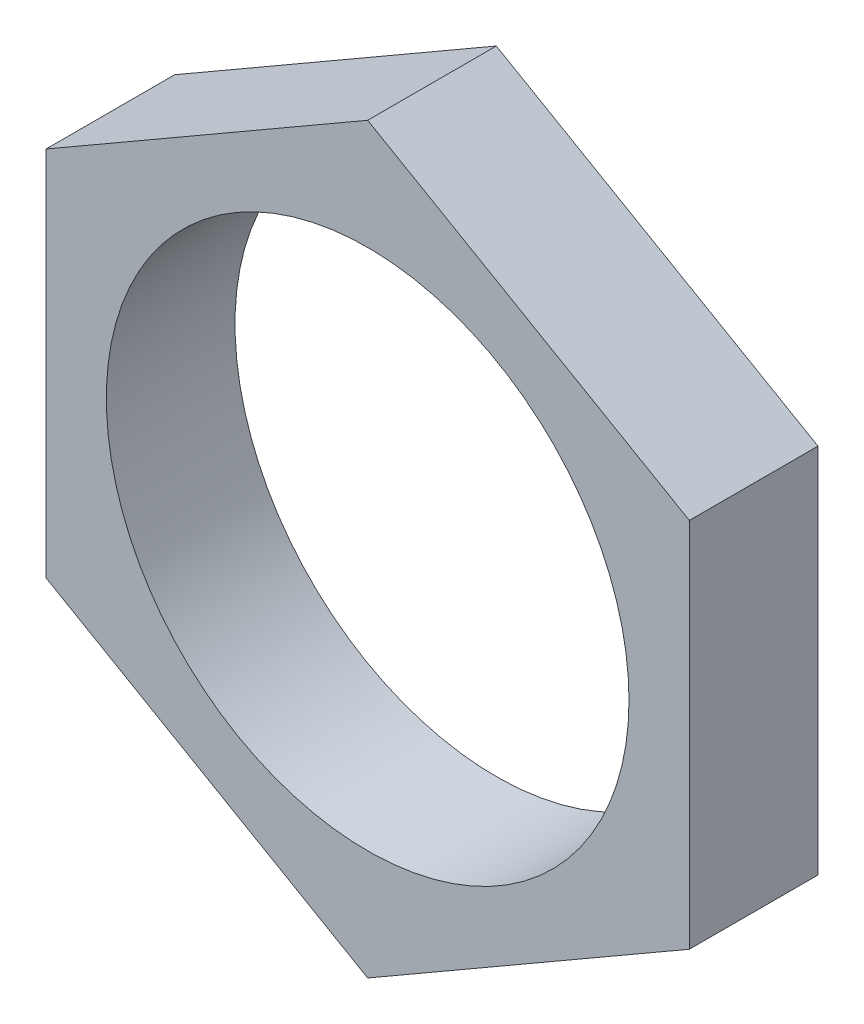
SolidWorks part; units mm, degrees
ref_plane "Front" through (0, 0, 0) normal (0, 0, 1) x (1, 0, 0)
ref_plane "Top" through (0, 0, 0) normal (0, 1, 0) x (1, 0, 0)
ref_plane "Right" through (0, 0, 0) normal (1, 0, 0) x (0, 0, -1)
sketch "Sketch1" plane through (0, 0, 0) normal (0, 0, 1) x (1, 0, 0)
  line L1 (-20, -11.547) -> (0, -23.094)
  line L2 (0, -23.094) -> (20, -11.547)
  line L3 (20, -11.547) -> (20, 11.547)
  line L4 (20, 11.547) -> (0, 23.094)
  line L5 (0, 23.094) -> (-20, 11.547)
  line L6 (-20, 11.547) -> (-20, -11.547)
  circle A0 centre (0, 0) radius 20 construction
  circle A1 centre (0, 0) radius 16.25
  circle A2 centre (0, 0) radius 18 construction
  dimension "D2" = 32.5
  dimension "D3" = 36
  dimension "D1" = 40
extrude "Extrude1" add sketch "Sketch1" along normal blind 8
